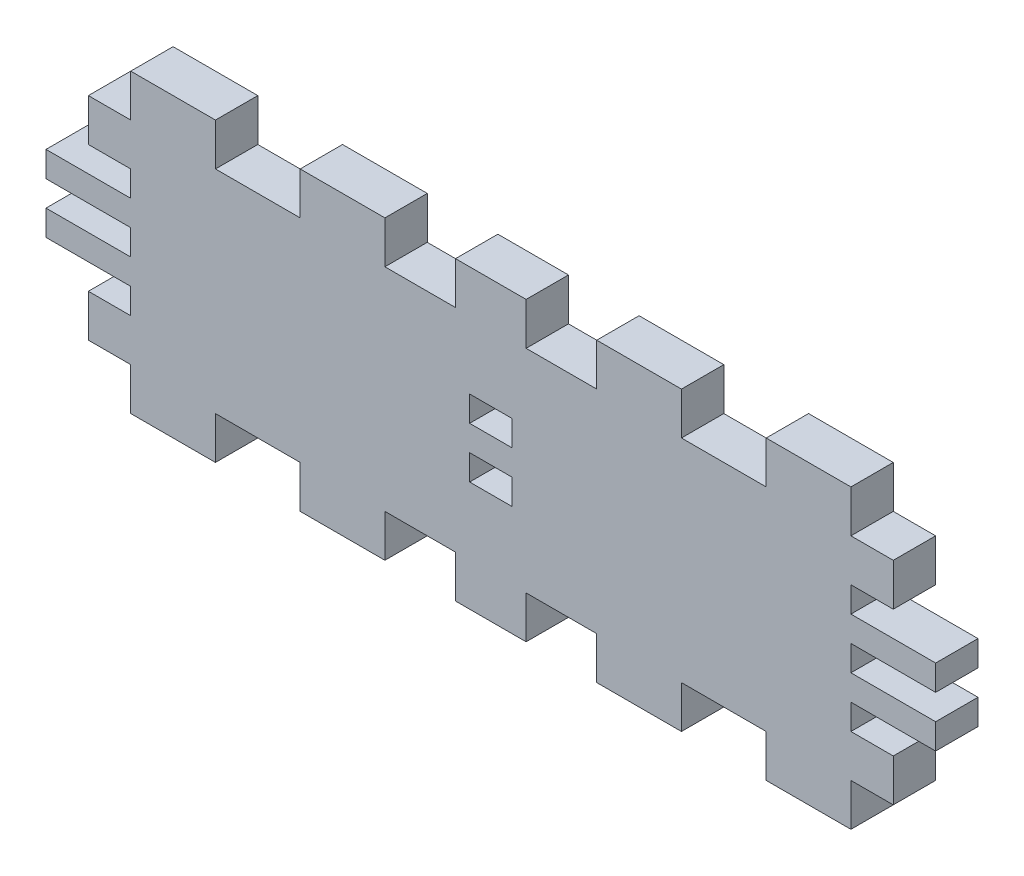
SolidWorks part; units mm, degrees
ref_plane "Front Plane" through (0, 0, 0) normal (0, 0, 1) x (1, 0, 0)
ref_plane "Top Plane" through (0, 0, 0) normal (0, 1, 0) x (1, 0, 0)
ref_plane "Right Plane" through (0, 0, 0) normal (1, 0, 0) x (0, 0, -1)
sketch "Sketch1" plane through (0, 0, 0) normal (0, 0, 1) x (1, 0, 0)
  line L1 (-31.5, -10.5) -> (31.5, -10.5)
  line L2 (-31.5, -10.5) -> (-31.5, 10.5)
  line L3 (-31.5, 10.5) -> (31.5, 10.5)
  line L4 (31.5, -10.5) -> (31.5, 10.5)
  line L5 (-31.5, -10.5) -> (31.5, 10.5) construction
  line L6 (-31.5, 10.5) -> (31.5, -10.5) construction
  point P0 (0, 0)
  dimension "D1" = 63
  dimension "D2" = 21
extrude "Boss-Extrude1" add sketch "Sketch1" along normal blind 3
sketch "Sketch2" plane through (0, 0, 0) normal (0, 0, -1) x (-1, 0, 0)
  line L1 (-1.5, 2.7) -> (1.5, 2.7)
  line L2 (-1.5, 2.7) -> (-1.5, 0.9)
  line L3 (-1.5, 0.9) -> (1.5, 0.9)
  line L4 (1.5, 2.7) -> (1.5, 0.9)
  line L5 (-1.5, -0.9) -> (1.5, -0.9)
  line L6 (-1.5, -0.9) -> (-1.5, -2.7)
  line L7 (-1.5, -2.7) -> (1.5, -2.7)
  line L8 (1.5, -0.9) -> (1.5, -2.7)
extrude "Cut-Extrude1" cut sketch "Sketch2" against normal blind 10
sketch "Sketch3" plane through (0, 0, 0) normal (0, 0, -1) x (-1, 0, 0)
  line L0 (-28.5, 2.7) -> (-31.5, 2.7)
  line L1 (-28.5, 4.5) -> (-25.5, 4.5)
  line L2 (-31.5, -10.5) -> (-31.5, 10.5) construction
  line L3 (-28.5, 2.7) -> (-25.5, 2.7)
  line L4 (-25.5, 4.5) -> (-25.5, 2.7)
  line L5 (-25.5, 0.9) -> (-31.5, 0.9)
  line L6 (-25.5, 0.9) -> (-25.5, -0.9)
  line L7 (-25.5, -0.9) -> (-31.5, -0.9)
  line L8 (-31.5, 0.9) -> (-31.5, -0.9)
  line L9 (-28.5, -2.7) -> (-25.5, -2.7)
  line L10 (-28.5, -2.7) -> (-31.5, -2.7)
  line L11 (-28.5, -4.5) -> (-25.5, -4.5)
  line L12 (-25.5, -2.7) -> (-25.5, -4.5)
  line L13 (28.5, -4.5) -> (25.5, -4.5)
  line L14 (28.5, 4.5) -> (28.5, 7.5)
  line L15 (28.5, -2.7) -> (25.5, -2.7)
  line L16 (25.5, -4.5) -> (25.5, -2.7)
  line L17 (25.5, -0.9) -> (31.5, -0.9)
  line L18 (25.5, -0.9) -> (25.5, 0.9)
  line L19 (25.5, 0.9) -> (31.5, 0.9)
  line L20 (31.5, -0.9) -> (31.5, 0.9)
  line L21 (28.5, 2.7) -> (25.5, 2.7)
  line L22 (28.5, 7.5) -> (31.5, 7.5)
  line L23 (28.5, 4.5) -> (25.5, 4.5)
  line L24 (25.5, 2.7) -> (25.5, 4.5)
  line L25 (-31.5, 2.7) -> (-31.5, 7.5)
  line L26 (-31.5, 7.5) -> (-28.5, 7.5)
  line L27 (-28.5, 7.5) -> (-28.5, 4.5)
  line L28 (-31.5, -2.7) -> (-31.5, -7.5)
  line L29 (-31.5, -7.5) -> (-28.5, -7.5)
  line L30 (-28.5, -7.5) -> (-28.5, -4.5)
  line L31 (31.5, 10.5) -> (31.5, -10.5) construction
  line L32 (31.5, 7.5) -> (31.5, 2.7)
  line L33 (31.5, 2.7) -> (28.5, 2.7)
  line L34 (28.5, -2.7) -> (31.5, -2.7)
  line L35 (31.5, -2.7) -> (31.5, -7.5)
  line L36 (31.5, -7.5) -> (28.5, -7.5)
  line L37 (28.5, -7.5) -> (28.5, -4.5)
extrude "Cut-Extrude2" cut sketch "Sketch3" against normal blind 10
sketch "Sketch4" plane through (0, 0, 0) normal (0, 0, -1) x (-1, 0, 0)
  line L0 (-31.5, -10.5) -> (-31.5, -7.5) construction
  line L1 (-25.5, 7.5) -> (-31.5, 7.5)
  line L2 (-25.5, 7.5) -> (-25.5, 10.5)
  line L3 (-25.5, 10.5) -> (-31.5, 10.5)
  line L4 (-31.5, 7.5) -> (-31.5, 10.5)
  line L5 (-31.5, 10.5) -> (31.5, 10.5) construction
  line L6 (31.5, 10.5) -> (31.5, 7.5) construction
  line L7 (-19.5, 7.5) -> (-13.5, 7.5)
  line L8 (-19.5, 7.5) -> (-19.5, 10.5)
  line L9 (-19.5, 10.5) -> (-13.5, 10.5)
  line L10 (-13.5, 7.5) -> (-13.5, 10.5)
  line L11 (-7.5, 7.5) -> (-2.5, 7.5)
  line L12 (-7.5, 7.5) -> (-7.5, 10.5)
  line L13 (-7.5, 10.5) -> (-2.5, 10.5)
  line L14 (-2.5, 7.5) -> (-2.5, 10.5)
  line L15 (2.5, 7.5) -> (7.5, 7.5)
  line L16 (2.5, 7.5) -> (2.5, 10.5)
  line L17 (2.5, 10.5) -> (7.5, 10.5)
  line L18 (7.5, 7.5) -> (7.5, 10.5)
  line L19 (19.5, 10.5) -> (13.5, 10.5)
  line L20 (19.5, 10.5) -> (19.5, 7.5)
  line L21 (19.5, 7.5) -> (13.5, 7.5)
  line L22 (13.5, 10.5) -> (13.5, 7.5)
  line L23 (-25.5, -7.5) -> (-31.5, -7.5)
  line L24 (25.5, 7.5) -> (25.5, 10.5)
  line L25 (25.5, 10.5) -> (31.5, 10.5)
  line L26 (31.5, 7.5) -> (31.5, 10.5)
  line L27 (31.5, -10.5) -> (-31.5, -10.5) construction
  line L28 (25.5, -7.5) -> (31.5, -7.5)
  line L29 (25.5, -7.5) -> (25.5, -10.5)
  line L30 (25.5, -10.5) -> (31.5, -10.5)
  line L31 (31.5, -7.5) -> (31.5, -10.5)
  line L33 (19.5, -7.5) -> (13.5, -7.5)
  line L34 (19.5, -7.5) -> (19.5, -10.5)
  line L35 (19.5, -10.5) -> (13.5, -10.5)
  line L36 (13.5, -7.5) -> (13.5, -10.5)
  line L37 (7.5, -7.5) -> (2.5, -7.5)
  line L38 (7.5, -7.5) -> (7.5, -10.5)
  line L39 (7.5, -10.5) -> (2.5, -10.5)
  line L40 (2.5, -7.5) -> (2.5, -10.5)
  line L41 (-2.5, -7.5) -> (-7.5, -7.5)
  line L42 (-2.5, -7.5) -> (-2.5, -10.5)
  line L43 (-2.5, -10.5) -> (-7.5, -10.5)
  line L44 (-7.5, -7.5) -> (-7.5, -10.5)
  line L45 (-13.5, -7.5) -> (-19.5, -7.5)
  line L46 (-13.5, -7.5) -> (-13.5, -10.5)
  line L47 (-13.5, -10.5) -> (-19.5, -10.5)
  line L48 (-19.5, -7.5) -> (-19.5, -10.5)
  line L49 (31.5, 7.5) -> (25.5, 7.5)
  line L50 (-25.5, -7.5) -> (-25.5, -10.5)
  line L51 (-25.5, -10.5) -> (-31.5, -10.5)
  line L52 (-31.5, -7.5) -> (-31.5, -10.5)
extrude "Cut-Extrude7" cut sketch "Sketch4" against normal blind 10
